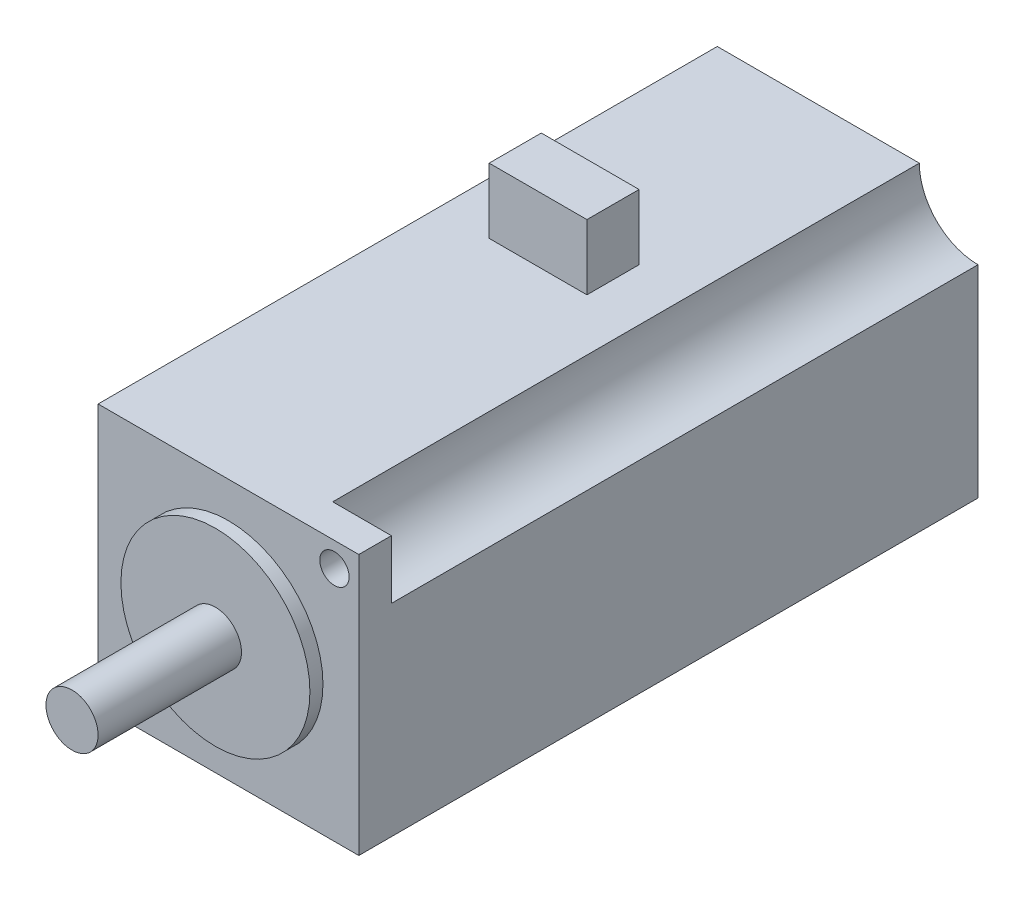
SolidWorks part; units mm, degrees
ref_plane "前基準面" through (0, 0, 0) normal (0, 0, 1) x (1, 0, 0)
ref_plane "上基準面" through (0, 0, 0) normal (0, 1, 0) x (1, 0, 0)
ref_plane "右基準面" through (0, 0, 0) normal (1, 0, 0) x (0, 0, -1)
sketch "草圖1" plane through (0, 0, 0) normal (0, 0, 1) x (1, 0, 0)
  line L0 (7214.0903, -418.2751) -> (7214.0903, -378.2751)
  line L1 (7174.0903, -418.2751) -> (7214.0903, -418.2751)
  line L2 (7214.0903, -378.2751) -> (7174.0903, -378.2751)
  line L3 (7174.0903, -378.2751) -> (7174.0903, -418.2751)
  circle A0 centre (7210.3538, -382.0117) radius 2.25
  circle A1 centre (7177.8269, -414.5386) radius 2.25
extrude "填料-伸長1" add sketch "草圖1" along normal blind 95
sketch "草圖2" plane through (0, 0, 95) normal (0, 0, 1) x (1, 0, 0)
  circle A0 centre (7194.0903, -398.2751) radius 14.5
  dimension "D1" = 29
extrude "填料-伸長2" add sketch "草圖2" along normal blind 2
sketch "草圖3" plane through (0, 0, 97) normal (0, 0, 1) x (1, 0, 0)
  circle A0 centre (7194.0903, -398.2751) radius 4
  dimension "D1" = 8
extrude "填料-伸長3" add sketch "草圖3" along normal blind 22
sketch "草圖4" plane through (0, 0, 0) normal (0, 0, -1) x (-1, 0, 0)
  circle A0 centre (-7214.0903, -378.2751) radius 9
  circle A1 centre (-7174.0903, -418.2751) radius 9
  dimension "D1" = 18
  dimension "D2" = 18
extrude "除料-伸長1" cut sketch "草圖4" against normal blind 90
sketch "草圖5" plane through (0, -378.2751, 0) normal (0, 1, 0) x (1, 0, 0)
  line L0 (7174.0903, -95) -> (7174.0903, 0) construction
  line L1 (7182.0903, -43) -> (7197.0903, -43)
  line L2 (7182.0903, -43) -> (7182.0903, -35)
  line L3 (7182.0903, -35) -> (7197.0903, -35)
  line L4 (7197.0903, -43) -> (7197.0903, -35)
  line L6 (7205.0903, 0) -> (7174.0903, 0) construction
  dimension "D1" = 15
  dimension "D2" = 8
  dimension "D3" = 35
  dimension "D4" = 8
extrude "填料-伸長4" add sketch "草圖5" along normal blind 10
